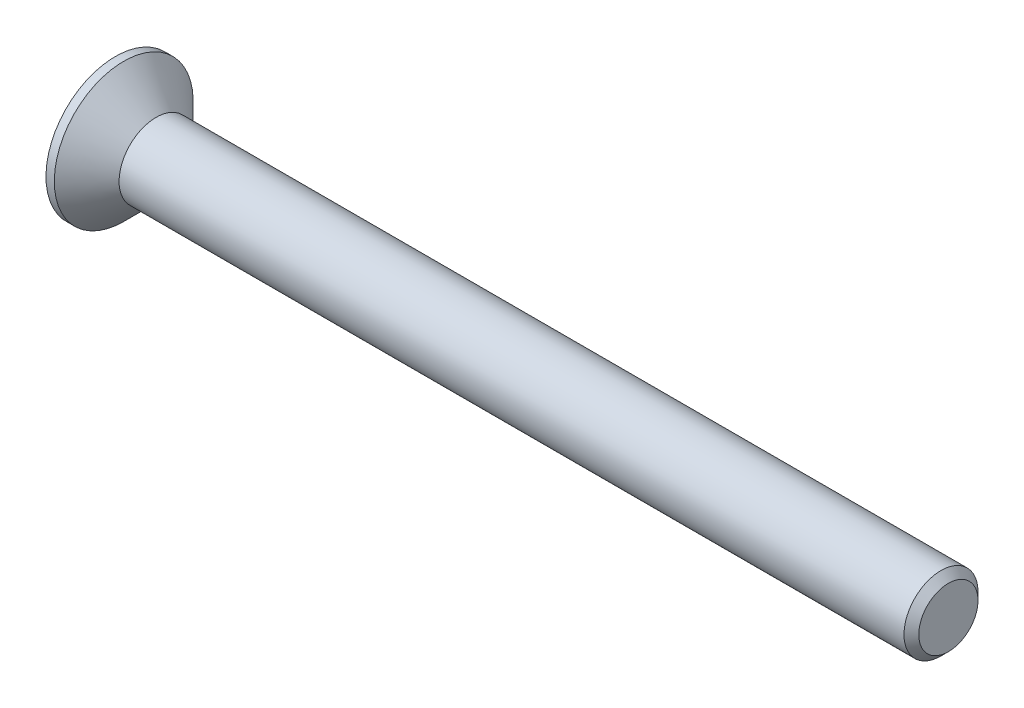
SolidWorks part; units mm, degrees
ref_plane "Front Plane" through (0, 0, 0) normal (0, 0, 1) x (1, 0, 0)
ref_plane "Top Plane" through (0, 0, 0) normal (0, 1, 0) x (1, 0, 0)
ref_plane "Right Plane" through (0, 0, 0) normal (1, 0, 0) x (0, 0, -1)
sketch "Sketch1" plane through (0, 0, 0) normal (0, 0, 1) x (1, 0, 0)
  line L1 (-2.2, 3.75) -> (-2.2, 0)
  line L2 (-2.2, 0) -> (42.8, 0)
  line L3 (42.8, 0) -> (42.8, 2)
  line L4 (42.8, 2) -> (0, 2)
  line L5 (-2.2, 3.75) -> (-1.75, 3.75)
  line L6 (-1.75, 3.75) -> (0, 2)
  dimension "D1" = 2
  dimension "D2" = 45
  dimension "D3" = 2.2
  dimension "D4" = 45
  dimension "D5" = 3.75
revolve "Revolve1" add sketch "Sketch1" angle 360 about L2
chamfer "Chamfer1" distance 0.4 angle 45 1 edges at (42.8, -2, 0)
sketch "Sketch2" plane through (-2.2, 0, 0) normal (-1, 0, 0) x (0, 0, 1)
  line L0 (-0.55, 2.2) -> (0.55, 2.2)
  line L1 (0.55, 2.2) -> (0.55, 0.55)
  line L2 (0.55, 0.55) -> (2.2, 0.55)
  line L3 (2.2, 0.55) -> (2.2, -0.55)
  line L4 (2.2, -0.55) -> (0.55, -0.55)
  line L5 (0.55, -0.55) -> (0.55, -2.2)
  line L6 (0.55, -2.2) -> (-0.55, -2.2)
  line L7 (-0.55, -2.2) -> (-0.55, -0.55)
  line L8 (-0.55, -0.55) -> (-2.2, -0.55)
  line L9 (-2.2, -0.55) -> (-2.2, 0.55)
  line L10 (-2.2, 0.55) -> (-0.55, 0.55)
  line L11 (-0.55, 0.55) -> (-0.55, 2.2)
  point P2 (0, 2.2)
  point P14 (0, -2.2)
  point P15 (2.2, 0)
  point P16 (-2.2, 0)
  dimension "D1" = 4.4
  dimension "D2" = 1.1
extrude "Cut-Extrude1" cut sketch "Sketch2" against normal blind 1.9
